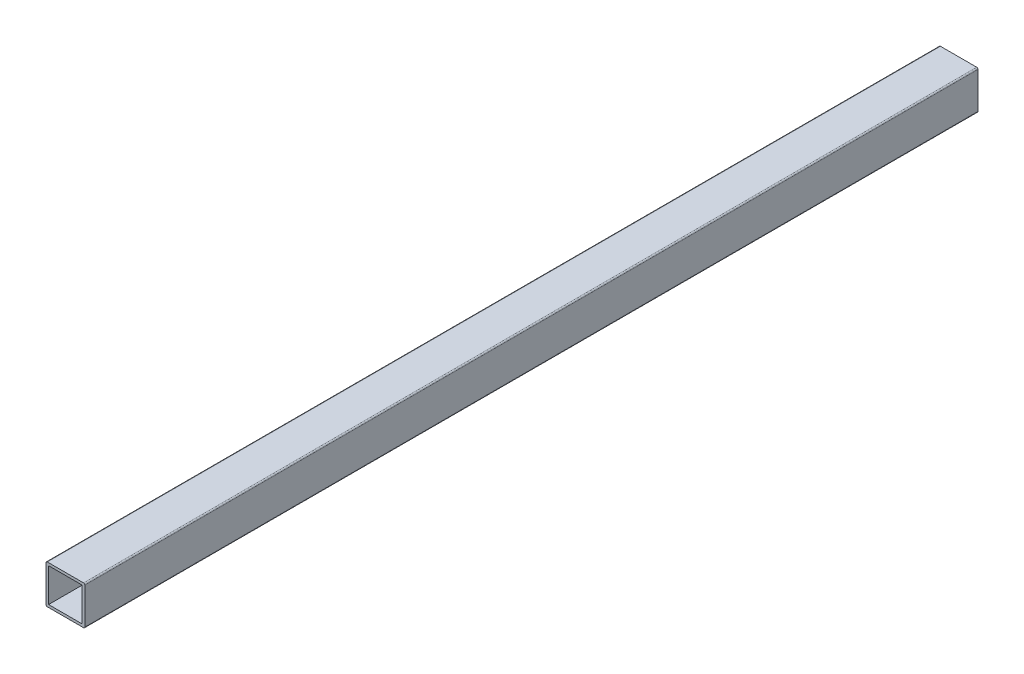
SolidWorks part; units mm, degrees
ref_plane "Plan1" through (0, 0, 0) normal (0, 0, 1) x (1, 0, 0)
ref_plane "Plan2" through (0, 0, 0) normal (0, 1, 0) x (1, 0, 0)
ref_plane "Plan3" through (0, 0, 0) normal (1, 0, 0) x (0, 0, -1)
sketch "Esquisse1" plane through (0, 0, 0) normal (0, 0, 1) x (1, 0, 0)
  line L0 (-14, 15) -> (14, 15)
  line L1 (-15, 14) -> (-15, -14)
  line L2 (14, -15) -> (-14, -15)
  line L3 (15, -14) -> (15, 14)
  line L4 (14, 14) -> (-14, -14) construction
  arc A0 (-14, -15) -> (-15, -14) centre (-14, -14) cw
  arc A1 (-15, 14) -> (-14, 15) centre (-14, 14) cw
  arc A2 (15, 14) -> (14, 15) centre (14, 14) ccw
  arc A3 (15, -14) -> (14, -15) centre (14, -14) cw
  dimension "D1" = 1
  dimension "D2" = 30
extrude "Base-Extru.-Mince" add sketch "Esquisse1" along normal blind 690 thin
sketch "Esquisse4" plane through (0, -15, 0) normal (0, -1, 0) x (1, 0, 0)
  line L1 (14, 690) -> (-14, 690) construction
  circle A0 centre (0, 645) radius 5
  circle A1 centre (0, 500) radius 5
  circle A2 centre (0, 190) radius 5
  circle A3 centre (0, 45) radius 5
  dimension "D1" = 10
  dimension "D2" = 145
  dimension "D3" = 145
  dimension "D4" = 45
  dimension "D5" = 310
  dimension "D6" = 45
extrude "Enlèv. mat.-Extru.4" cut sketch "Esquisse4" against normal blind 3
